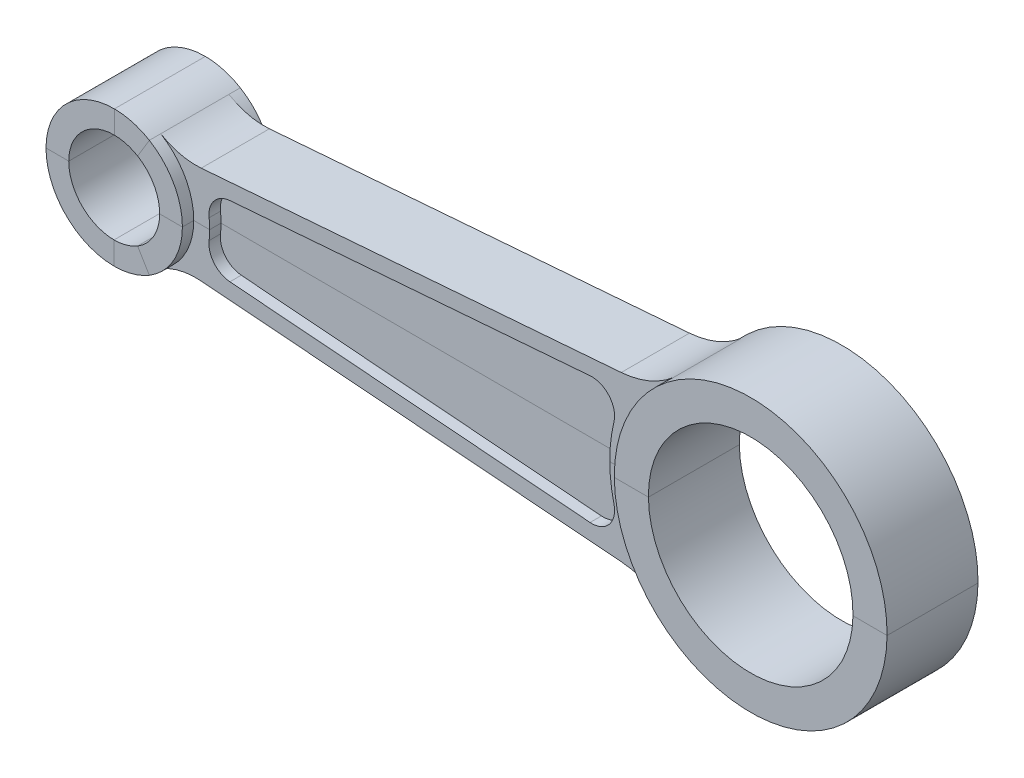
SolidWorks part; units mm, degrees
ref_plane "Front Plane" through (0, 0, 0) normal (0, 0, 1) x (1, 0, 0)
ref_plane "Top Plane" through (0, 0, 0) normal (0, 1, 0) x (1, 0, 0)
ref_plane "Right Plane" through (0, 0, 0) normal (1, 0, 0) x (0, 0, -1)
sketch "Sketch1" plane through (0, 0, 0) normal (0, 1, 0) x (1, 0, 0)
  line L0 (38.1, 25.4) -> (0, 25.4)
  line L1 (0, 25.4) -> (0, 19.05)
  line L2 (0, 19.05) -> (38.1, 19.05)
  line L3 (38.1, 19.05) -> (38.1, 25.4)
  line L4 (0, 25.4) -> (0, 19.05) construction
revolve "Revolve1" add sketch "Sketch1" angle 360 about L4
sketch "Sketch2" plane through (0, 0, -19.05) normal (0, 0, 1) x (1, 0, 0)
  line L0 (295.8347, -47.271) -> (42.2666, -27.3147)
  line L1 (42.2666, 27.3147) -> (295.8347, 47.271)
  arc A0 (295.8347, 47.271) -> (295.8347, -47.271) centre (355.6, 0) cw
  arc A1 (42.2666, -27.3147) -> (19.6386, -32.6486) centre (39.2773, -65.2973) ccw
  arc A2 (19.6386, -32.6486) -> (19.6386, 32.6486) centre (0, 0) cw
  arc A3 (19.6386, 32.6486) -> (42.2666, 27.3147) centre (39.2773, 65.2973) ccw
extrude "Boss-Extrude1" add sketch "Sketch2" along normal blind 44.45
sketch "Sketch3" plane through (0, 0, 25.4) normal (0, 0, 1) x (1, 0, 0)
  line L0 (42.2666, -27.3147) -> (295.8347, -47.271)
  line L1 (295.8347, 47.271) -> (42.2666, 27.3147)
  arc A0 (295.8347, -47.271) -> (295.8347, 47.271) centre (355.6, 0) cw
  arc A1 (42.2666, 27.3147) -> (19.6386, 32.6486) centre (39.2773, 65.2973) cw
  arc A2 (19.6386, 32.6486) -> (19.6386, -32.6486) centre (0, 0) cw
  arc A3 (19.6386, -32.6486) -> (42.2666, -27.3147) centre (39.2773, -65.2973) cw
extrude "Cut-Extrude1" cut sketch "Sketch3" against normal blind 6.35
sketch "Sketch4" plane through (0, 0, -19.05) normal (0, 0, -1) x (-1, 0, 0)
  circle A0 centre (-355.6, 0) radius 76.2
extrude "Boss-Extrude2" add sketch "Sketch4" along normal blind 6.35
sketch "Sketch5" plane through (0, 0, -19.05) normal (0, 0, -1) x (-1, 0, 0)
  line L0 (-43.2073, 18.4713) -> (-259.5169, 35.4952)
  line L1 (-259.5169, -35.4952) -> (-43.2073, -18.4713)
  arc A0 (-43.2073, -18.4713) -> (-43.2073, 18.4713) centre (0, 0) cw
  arc A1 (-259.5169, 35.4952) -> (-272.8622, 19.8689) centre (-260.5133, 22.8344) ccw
  arc A2 (-272.8622, 19.8689) -> (-272.8622, -19.8689) centre (-355.6, 0) cw
  arc A3 (-272.8622, -19.8689) -> (-259.5169, -35.4952) centre (-260.5133, -22.8344) ccw
extrude "Cut-Extrude2" cut sketch "Sketch5" against normal blind 6.35
sketch "Sketch6" plane through (0, 0, 19.05) normal (0, 0, 1) x (1, 0, 0)
  line L0 (259.5169, 35.4952) -> (43.2073, 18.4713)
  line L1 (43.2073, -18.4713) -> (259.5169, -35.4952)
  arc A0 (43.2073, 18.4713) -> (43.2073, -18.4713) centre (0, 0) cw
  arc A1 (259.5169, -35.4952) -> (272.8622, -19.8689) centre (260.5133, -22.8344) ccw
  arc A2 (272.8622, -19.8689) -> (272.8622, 19.8689) centre (355.6, 0) cw
  arc A3 (272.8622, 19.8689) -> (259.5169, 35.4952) centre (260.5133, 22.8344) ccw
extrude "Cut-Extrude3" cut sketch "Sketch6" against normal blind 6.35
hole_wizard "Hole1" positions "Sketch8" profile "Sketch7" legacy
sketch "Sketch8" plane through (0, 0, 25.4) normal (0, 0, 1) x (1, 0, 0)
  point P0 (355.6, 0)
sketch "Sketch7" plane through (355.6, 0, 25.4) normal (1, 0, 0) x (0, -1, 0)
  line L0 (0, 0) -> (0, 50.8)
  line L1 (0, 50.8) -> (57.15, 50.8)
  line L2 (57.15, 50.8) -> (57.15, 0)
  line L3 (57.15, 0) -> (0, 0)
  line L4 (0, 110) -> (0, -10) construction
  dimension "Diameter" = 114.3
  dimension "Depth" = 50.8
hole_wizard "Hole2" positions "Sketch10" profile "Sketch9" legacy
sketch "Sketch10" plane through (0, 0, 25.4) normal (0, 0, 1) x (1, 0, 0)
  point P0 (0, 0)
sketch "Sketch9" plane through (0, 0, 25.4) normal (1, 0, 0) x (0, -1, 0)
  line L0 (0, 0) -> (0, 50.8)
  line L1 (0, 50.8) -> (25.4, 50.8)
  line L2 (25.4, 50.8) -> (25.4, 0)
  line L3 (25.4, 0) -> (0, 0)
  line L4 (0, 110) -> (0, -10) construction
  dimension "Diameter" = 50.8
  dimension "Depth" = 50.8
fillet "Fillet1" radius 12.7 4 edges at (43.2073, 18.4713, 15.875) (43.2073, -18.4713, 15.875) (43.2073, 18.4713, -15.875) (43.2073, -18.4713, -15.875)
fillet "Fillet2" radius 50.8 2 edges at (295.8347, -47.271, 0) (295.8347, 47.271, 0)
sketch "Sketch11" plane through (0, 0, 25.4) normal (0, 0, 1) x (1, 0, 0)
  line L0 (0, 0) -> (0.2425, 70.8754)
  line L1 (0, 0) -> (-0.1925, -56.2477)
  point P0 (0, 0)
sketch "Sketch12" plane through (0, 0, 25.4) normal (0, 0, 1) x (1, 0, 0)
  line L0 (0, 0) -> (26.9831, 44.8586)
  line L1 (0, 0) -> (34.612, -57.5414)
  line L2 (0, 0) -> (0.15, 44.3977) construction
  line L3 (0, 0) -> (-0.203, -60.1108) construction
  arc A0 (42.2666, -27.3147) -> (19.6386, -32.6486) centre (39.2773, -65.2973) ccw construction
  arc A1 (19.6386, 32.6486) -> (42.2666, 27.3147) centre (39.2773, 65.2973) ccw construction
  arc A2 (42.2666, -27.3147) -> (19.6386, -32.6486) centre (39.2773, -65.2973) ccw construction
  arc A3 (19.6386, 32.6486) -> (42.2666, 27.3147) centre (39.2773, 65.2973) ccw construction
  point P0 (0, 0)
sketch "Sketch13" plane through (0, 0, 25.4) normal (0, 0, 1) x (1, 0, 0)
  line L0 (0, 0) -> (481.8767, -0.9696)
  line L1 (0, 0) -> (-73.6225, 0.1481)
  point P0 (0, 0)
